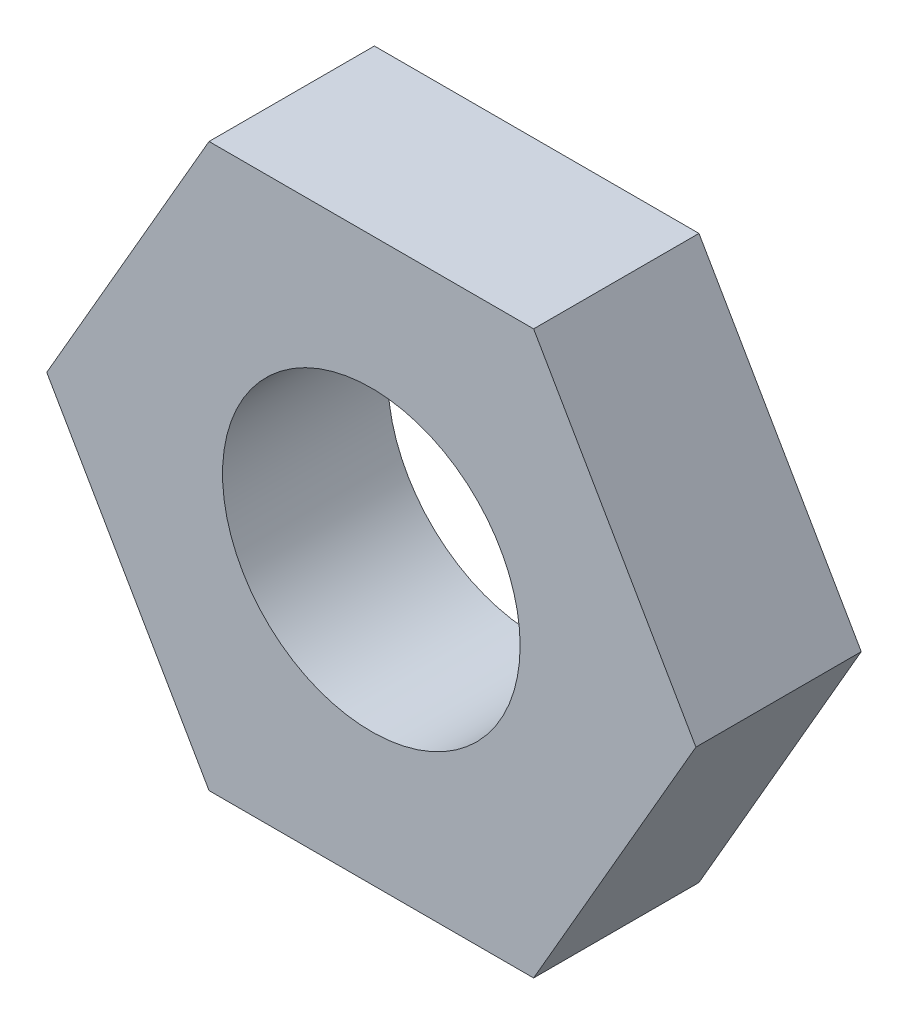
SolidWorks part; units mm, degrees
ref_plane "Plan de face" through (0, 0, 0) normal (0, 0, 1) x (1, 0, 0)
ref_plane "Plan de dessus" through (0, 0, 0) normal (0, 1, 0) x (1, 0, 0)
ref_plane "Plan de droite" through (0, 0, 0) normal (1, 0, 0) x (0, 0, -1)
sketch "Esquisse1" plane through (0, 0, 0) normal (0, 0, 1) x (1, 0, 0)
  line L0 (0, 0) -> (75.5457, 0) construction
  line L1 (4.9075, 8.5) -> (-4.9075, 8.5)
  line L2 (-4.9075, 8.5) -> (-9.815, 0)
  line L3 (-9.815, 0) -> (-4.9075, -8.5)
  line L4 (-4.9075, -8.5) -> (4.9075, -8.5)
  line L5 (4.9075, -8.5) -> (9.815, 0)
  line L6 (9.815, 0) -> (4.9075, 8.5)
  circle A0 centre (0, 0) radius 8.5 construction
  dimension "D1" = 17
extrude "Extrusion1" add sketch "Esquisse1" along normal blind 5
hole_wizard "Trou taraudé M10x1.01" positions "Esquisse4" profile "Esquisse3" tap size "M10x1.0" standard "ISO"
sketch "Esquisse4" plane through (0, 0, 5) normal (0, 0, 1) x (1, 0, 0)
  point P0 (0, 0)
sketch "Esquisse3" plane through (0, 0, 5) normal (1, 0, 0) x (0, -1, 0)
  line L0 (0, 0) -> (0, 5)
  line L1 (0, 5) -> (4.5, 5)
  line L2 (4.5, 5) -> (4.5, 0)
  line L5 (4.5, 0) -> (0, 0)
  line L11 (0, -6.35) -> (0, 107.95) construction
  dimension "Diamètre du trou pour taraudage jusqu'au prochain" = 9
  dimension "Profondeur du trou pour taraudage jusqu'au prochain" = 5
